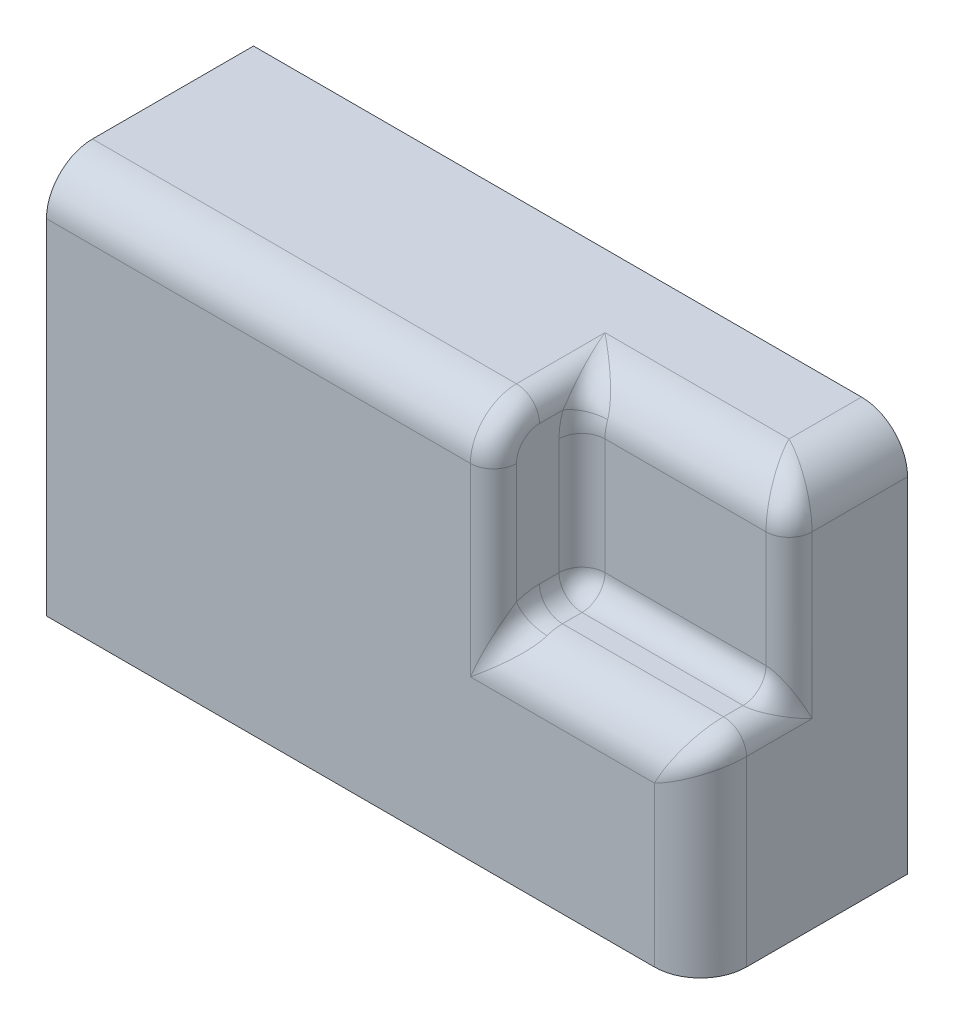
SolidWorks part; units mm, degrees
ref_plane "Front Plane" through (0, 0, 0) normal (0, 0, 1) x (1, 0, 0)
ref_plane "Top Plane" through (0, 0, 0) normal (0, 1, 0) x (1, 0, 0)
ref_plane "Right Plane" through (0, 0, 0) normal (1, 0, 0) x (0, 0, -1)
sketch "Sketch1" plane through (0, 0, 0) normal (0, 0, 1) x (1, 0, 0)
  line L1 (0, 0) -> (72.2061, 0)
  line L2 (0, 0) -> (0, 43.0703)
  line L3 (0, 43.0703) -> (72.2061, 43.0703)
  line L4 (72.2061, 0) -> (72.2061, 43.0703)
extrude "Boss-Extrude1" add sketch "Sketch1" along normal blind 22.86
sketch "Sketch2" plane through (72.2061, 0, 0) normal (1, 0, 0) x (0, 0, -1)
  line L1 (-22.86, 43.0703) -> (-13.0839, 43.0703)
  line L2 (-22.86, 43.0703) -> (-22.86, 22.6643)
  line L3 (-22.86, 22.6643) -> (-13.0839, 22.6643)
  line L4 (-13.0839, 43.0703) -> (-13.0839, 22.6643)
extrude "Cut-Extrude1" cut sketch "Sketch2" against normal blind 22.86
fillet "Fillet1" radius 5.08 5 edges at (60.7761, 43.0703, 13.0839) (60.7761, 22.6643, 22.86) (24.6731, 43.0703, 22.86) (72.2061, 11.3321, 22.86) (72.2061, 43.0703, 6.542)
fillet "Fillet2" radius 2.54 7 edges at (70.7182, 21.1764, 21.3721) (70.7182, 41.5824, 11.596) (49.3461, 43.0703, 12.892) (49.3461, 41.5824, 21.3721) (72.2061, 22.6643, 15.432) (72.2061, 30.3273, 13.0839) (49.3461, 27.7873, 22.86)
fillet "Fillet3" radius 2.54 8 edges at (71.4622, 21.9203, 12.34) (48.5145, 20.089, 22.1996) (49.3461, 22.4912, 19.0948) (48.5145, 42.4099, 10.5086) (49.3461, 39.3051, 12.9108) (59.5061, 22.6643, 13.0839) (49.3461, 22.6643, 15.432) (49.3461, 30.3273, 13.0839)
